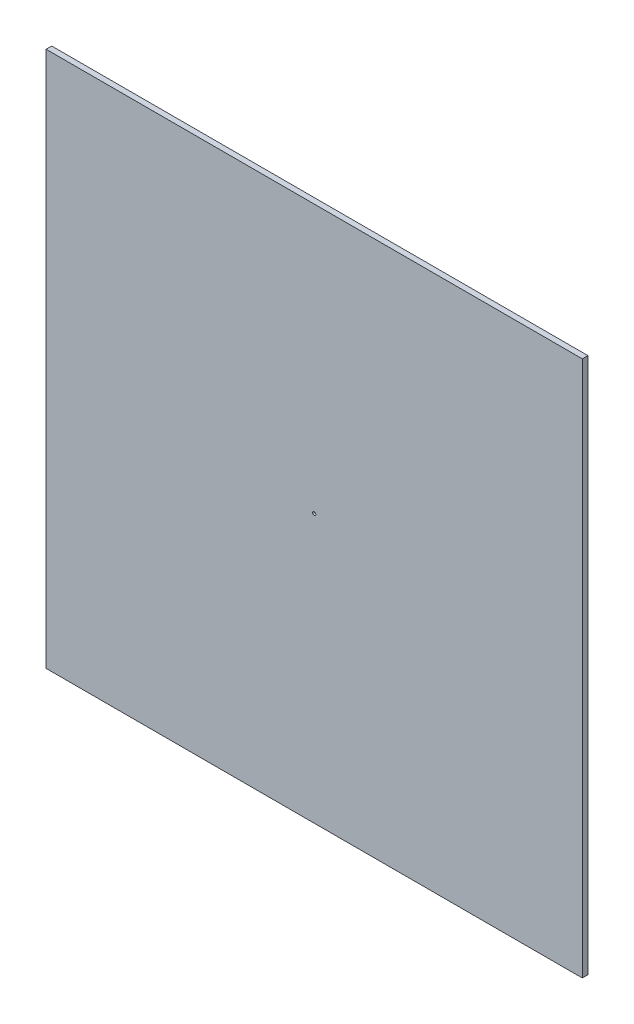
SolidWorks part; units mm, degrees
ref_plane "Front Plane" through (0, 0, 0) normal (0, 0, 1) x (1, 0, 0)
ref_plane "Top Plane" through (0, 0, 0) normal (0, 1, 0) x (1, 0, 0)
ref_plane "Right Plane" through (0, 0, 0) normal (1, 0, 0) x (0, 0, -1)
sketch "Sketch1" plane through (0, 0, 0) normal (0, 0, 1) x (1, 0, 0)
  line L1 (0, 0) -> (266.7, 0)
  line L2 (0, 0) -> (0, -266.7)
  line L3 (0, -266.7) -> (266.7, -266.7)
  line L4 (266.7, 0) -> (266.7, -266.7)
  dimension "D1" = 266.7
extrude "Boss-Extrude1" add sketch "Sketch1" along normal blind 2.794
sketch "Sketch2" plane through (0, 0, 2.794) normal (0, 0, 1) x (1, 0, 0)
  line L0 (0, 0) -> (266.7, -266.7) construction
  circle A0 centre (133.35, -133.35) radius 0.7937
  dimension "D1" = 1.5875
extrude "Cut-Extrude1" cut sketch "Sketch2" against normal through all
